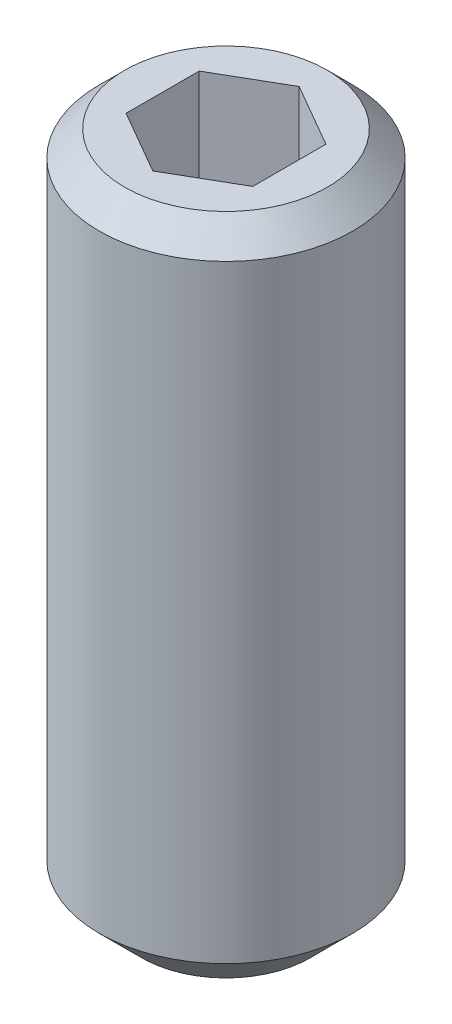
SolidWorks part; units mm, degrees
ref_plane "Face" through (0, 0, 0) normal (0, 0, 1) x (1, 0, 0)
ref_plane "Dessus" through (0, 0, 0) normal (0, 1, 0) x (1, 0, 0)
ref_plane "Droite" through (0, 0, 0) normal (1, 0, 0) x (0, 0, -1)
sketch "Esquisse1" plane through (0, 0, 0) normal (0, 0, 1) x (1, 0, 0)
  line L0 (0, -8) -> (0, 0) construction
  line L1 (0.75, 0) -> (1.2, 0)
  line L2 (1.2, 0) -> (1.5, -0.3)
  line L3 (0.75, 0) -> (0.75, -1.5)
  line L4 (0.75, -1.5) -> (0, -1.933)
  line L5 (1.5, -0.3) -> (1.5, -7.5)
  line L6 (0, -8) -> (0, -1.933)
  line L7 (-1.5, 0) -> (1.5, 0) construction
  line L9 (0, -8) -> (1, -8)
  line L10 (1, -8) -> (1.5, -7.5)
  line L11 (-1, 0) -> (1, 0) construction
  dimension "D2" = 45
  dimension "D4" = 0.75
  dimension "D1" = 1.5
  dimension "Diamètre nominal" = 3
  dimension "D3" = 0.3
  dimension "D5" = 120
  dimension "Cote sur plats" = 1.5
  dimension "D6" = 1
  dimension "D7" = 45
  dimension "Diamètre d1" = 2
  dimension "Longueur" = 8
revolve "Base-Révolution" add sketch "Esquisse1" angle 360 about L0
sketch "Esquisse2" plane through (0, 0, 0) normal (0, 1, 0) x (-1, 0, 0)
  line L0 (0, 0) -> (0.75, 0) construction
  line L1 (0, 0) -> (1.299, 0.75) construction
  line L2 (0, 0) -> (0.75, 1.299) construction
  line L3 (0, 0) -> (0, 1.5) construction
  line L4 (0.75, -0.433) -> (0.75, 0.433)
  line L5 (0.75, 0.433) -> (0, 0.866)
  line L6 (-0.75, 0.433) -> (0, 0.866)
  line L7 (-0.75, -0.433) -> (-0.75, 0.433)
  line L8 (0.75, -0.433) -> (0, -0.866)
  line L9 (-0.75, -0.433) -> (0, -0.866)
  circle A0 centre (0, 0) radius 0.75 construction
  circle A2 centre (0, 0) radius 1.5 construction
  point P17 (-0.75, 0)
  dimension "D1" = 30
  dimension "D2" = 30
extrude "Enlèv. mat.-Extru.1" cut sketch "Esquisse2" against normal blind 1.5
